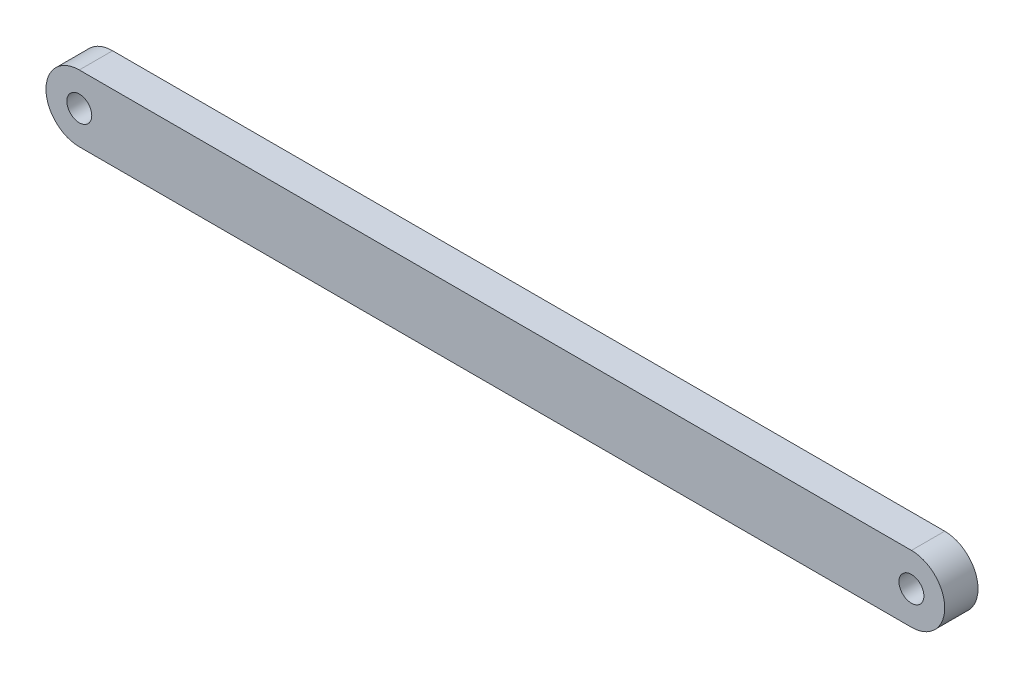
SolidWorks part; units mm, degrees
ref_plane "前视基准面" through (0, 0, 0) normal (0, 0, 1) x (1, 0, 0)
ref_plane "上视基准面" through (0, 0, 0) normal (0, 1, 0) x (1, 0, 0)
ref_plane "右视基准面" through (0, 0, 0) normal (1, 0, 0) x (0, 0, -1)
sketch "草图1" plane through (0, 0, 0) normal (0, 0, 1) x (1, 0, 0)
  line L0 (-50, 0) -> (50, 0) construction
  line L1 (-50, 4) -> (50, 4)
  line L2 (-50, -4) -> (50, -4)
  arc A0 (-50, 4) -> (-50, -4) centre (-50, 0) ccw
  arc A1 (50, -4) -> (50, 4) centre (50, 0) ccw
  circle A2 centre (-50, 0) radius 1.5
  circle A3 centre (50, 0) radius 1.5
  point P2 (0, 0)
extrude "凸台-拉伸1" add sketch "草图1" along normal blind 4
